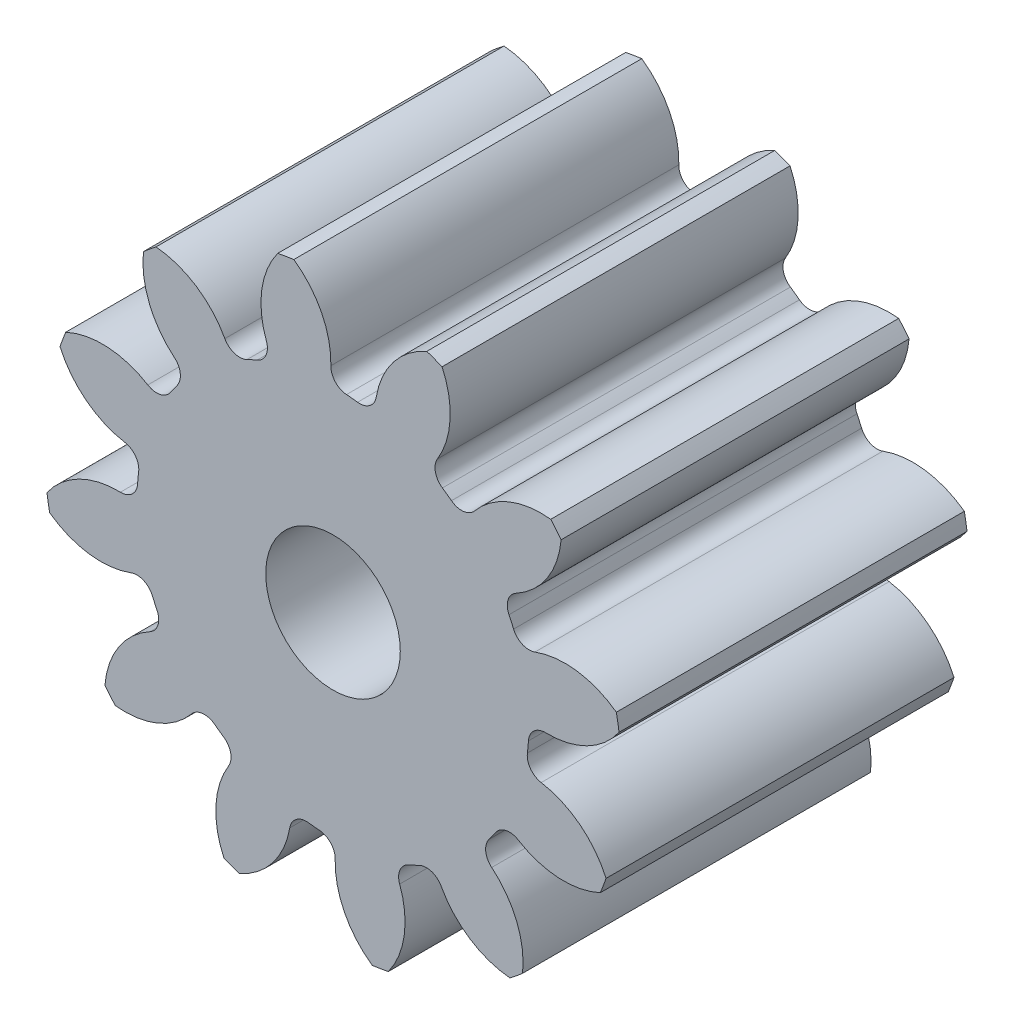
SolidWorks part; units mm, degrees
ref_plane "Front" through (0, 0, 0) normal (0, 0, 1) x (1, 0, 0)
ref_plane "Top" through (0, 0, 0) normal (0, 1, 0) x (1, 0, 0)
ref_plane "Right" through (0, 0, 0) normal (1, 0, 0) x (0, 0, -1)
sketch "Sketch3" plane through (0, 0, 0) normal (0, 0, 1) x (1, 0, 0)
  circle A0 centre (0, 0) radius 79.0222
  dimension "od" = 158.0444
extrude "gearBody" add sketch "Sketch3" along normal blind 95.25
sketch "Sketch2" plane through (0, 0, 0) normal (0, 0, 1) x (1, 0, 0)
  line L0 (0, 0) -> (58.8036, 24.3572) construction
  line L1 (75.2397, -26.9051) -> (0, 0) construction
  line L2 (0, 0) -> (36.3143, 0) construction
  line L3 (67.694, 2.3066) -> (65.9704, -15.3531) construction
  line L5 (66.8322, -6.5232) -> (0, 0) construction
  line L7 (0, 0) -> (63.6485, 0) construction
  arc A0 (63.6394, 1.0788) -> (62.2296, -13.3644) centre (0, 0) ccw construction
  arc A1 (78.2896, 10.7351) -> (74.7362, -25.6713) centre (0, 0) ccw construction
  arc A2 (67.694, 2.3066) -> (65.9704, -15.3531) centre (0, 0) ccw construction
  arc A3 (53.1987, -6.7264) -> (53.4953, -3.6875) centre (0, 0) ccw
  arc A4 (75.2397, -26.9051) -> (56.9839, -11.8319) centre (52.9838, -35.2683) ccw
  arc A5 (75.2397, -26.9051) -> (79.0222, 11.8483) centre (0, 0) ccw
  arc A6 (79.0222, 11.8483) -> (58.1963, 0.5896) centre (58.8036, 24.3572) cw
  arc A7 (53.4953, -3.6875) -> (58.1963, 0.5896) centre (58.079, -4.0035) cw
  arc A8 (56.9839, -11.8319) -> (53.1987, -6.7264) centre (57.7569, -7.3028) cw
  point P6 (79.0222, 11.8483)
  point P22 (75.2397, -26.9051)
  dimension "baseDia" = 127.297
  dimension "od" = 158.0444
  dimension "pd" = 135.4667
  dimension "rd" = 107.2444
  dimension "rFillet" = 4.5946
  dimension "pointX" = 79.0222
  dimension "pointY" = 11.8483
  dimension "CTT" = 17.6597
  dimension "flankCenterAngle" = 22.5
extrude "toothCut" cut sketch "Sketch2" along normal through all
pattern_circular "CirPattern1" count 12 over 360 about axis through (0, 0, 0) along (0, 0, 1) of "toothCut"
sketch "hub1Dia" plane through (0, 0, 0) normal (0, 0, -1) x (-1, 0, 0)
  circle A0 centre (0, 0) radius 12.7
  dimension "hub1Dia" = 25.4
sketch "hub2Dia" plane through (0, 0, 95.25) normal (0, 0, 1) x (1, 0, 0)
  circle A0 centre (0, 0) radius 12.7
  dimension "hub2dia" = 25.4
sketch "boreDia" plane through (0, 0, 0) normal (0, 0, 1) x (1, 0, 0)
  circle A0 centre (0, 0) radius 18.415
  dimension "boreDia" = 36.83
extrude "bore" cut sketch "boreDia" against normal mid plane 25400
